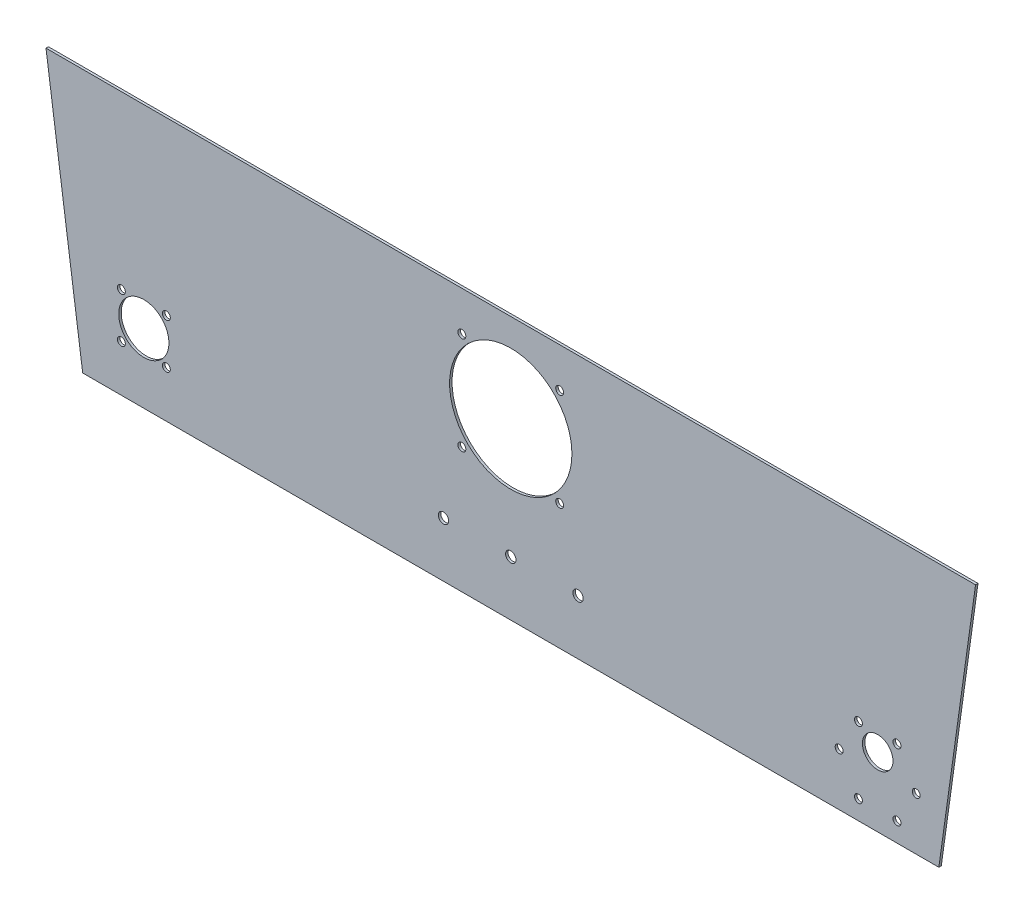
SolidWorks part; units mm, degrees
ref_plane "Front Plane" through (0, 0, 0) normal (0, 0, 1) x (1, 0, 0)
ref_plane "Top Plane" through (0, 0, 0) normal (0, 1, 0) x (1, 0, 0)
ref_plane "Right Plane" through (0, 0, 0) normal (1, 0, 0) x (0, 0, -1)
sketch "Sketch4" plane through (0, 0, 0) normal (0, 0, 1) x (1, 0, 0)
  line L0 (-150.2179, -37.7691) -> (199.7821, -37.7691)
  line L1 (174.7821, -9.5191) -> (174.7821, -16.2716) construction
  line L2 (159.0321, -16.2716) -> (190.5321, -16.2716) construction
  line L3 (24.7821, -37.7691) -> (24.7821, -9.5191) construction
  line L4 (-125.2179, -9.5191) -> (-110.2179, -9.5191) construction
  line L5 (199.7821, -37.7691) -> (214.7862, 69.7399)
  line L6 (214.7862, 69.7399) -> (-165.2138, 69.7399)
  line L7 (-165.2138, 69.7399) -> (-150.2179, -37.7691)
  line L8 (-125.2179, -9.5191) -> (-134.4103, -0.3267) construction
  line L9 (-125.2179, -9.5191) -> (-116.0255, -0.3267) construction
  line L10 (-125.2179, -9.5191) -> (-134.4103, -18.7115) construction
  line L11 (-125.2179, -9.5191) -> (-116.0255, -18.7115) construction
  line L12 (-125.2179, -9.5191) -> (174.7821, -9.5191) construction
  line L13 (24.7821, -37.7691) -> (24.7821, -15.3591) construction
  circle A0 centre (-125.2179, -9.5191) radius 10.25
  circle A1 centre (174.7821, -9.5191) radius 6.25
  circle A8 centre (-116.0255, -0.3267) radius 1.625
  circle A9 centre (-134.4103, -18.7115) radius 1.625
  circle A10 centre (-116.0255, -18.7115) radius 1.625
  circle A11 centre (-134.4103, -0.3267) radius 1.625
  circle A12 centre (159.0321, -16.2716) radius 1.625
  circle A13 centre (166.9071, -2.6317) radius 1.625
  circle A14 centre (182.6571, -2.6317) radius 1.625
  circle A15 centre (190.5321, -16.2716) radius 1.625
  circle A16 centre (182.6571, -29.9115) radius 1.625
  circle A17 centre (166.9071, -29.9115) radius 1.625
  circle A18 centre (24.7821, -15.3591) radius 2.125
  circle A19 centre (-2.7179, -15.3591) radius 2.125
  circle A20 centre (52.2821, -15.3591) radius 2.125
  point P14 (174.7821, -16.2716)
  point P25 (-125.2179, -9.5191)
  point P32 (24.7821, -9.5191)
  point P34 (24.7821, -37.7691)
  point P40 (24.7821, -15.3591)
  dimension "D2" = 20.5
  dimension "D5" = 3.25
  dimension "D6" = 3.25
  dimension "D11" = 13
  dimension "D16" = 12.5
  dimension "D19" = 3.25
  dimension "D22" = 4.25
  dimension "D1" = 350
  dimension "D3" = 15
  dimension "D4" = 26
  dimension "D7" = 28.25
  dimension "D8" = 380
  dimension "D9" = 107.509
  dimension "D10" = 107.509
  dimension "D12" = 45
  dimension "D13" = 300
  dimension "D14" = 82.055
  dimension "D15" = 82.059
  dimension "D17" = 6.7525
  dimension "D18" = 31.5
  dimension "D21" = 22.41
  dimension "D23" = 55
  dimension "D20" = 6
extrude "Boss-Extrude2" add sketch "Sketch4" along normal blind 1
sketch "Sketch5" plane through (0, 0, 1) normal (0, 0, 1) x (1, 0, 0)
  line L0 (24.7821, -37.7691) -> (24.7862, 69.7399) construction
  line L1 (-150.2179, -37.7691) -> (199.7821, -37.7691) construction
  line L2 (214.7862, 69.7399) -> (-165.2138, 69.7399) construction
  line L8 (4.7848, 53.5439) -> (44.7848, 13.5439) construction
  line L9 (4.7848, 13.5439) -> (44.7848, 53.5439) construction
  circle A0 centre (4.7848, 53.5439) radius 1.625
  circle A1 centre (44.7848, 53.5439) radius 1.625
  circle A2 centre (4.7848, 13.5439) radius 1.625
  circle A3 centre (44.7848, 13.5439) radius 1.625
  circle A4 centre (24.7848, 33.5439) radius 25
  point P6 (24.7848, 33.5439)
  dimension "D3" = 3.25
  dimension "D4" = 3.25
  dimension "D5" = 3.25
  dimension "D6" = 3.25
  dimension "D7" = 50
  dimension "D1" = 40
  dimension "D2" = 40
extrude "Cut-Extrude1" cut sketch "Sketch5" against normal blind 10
